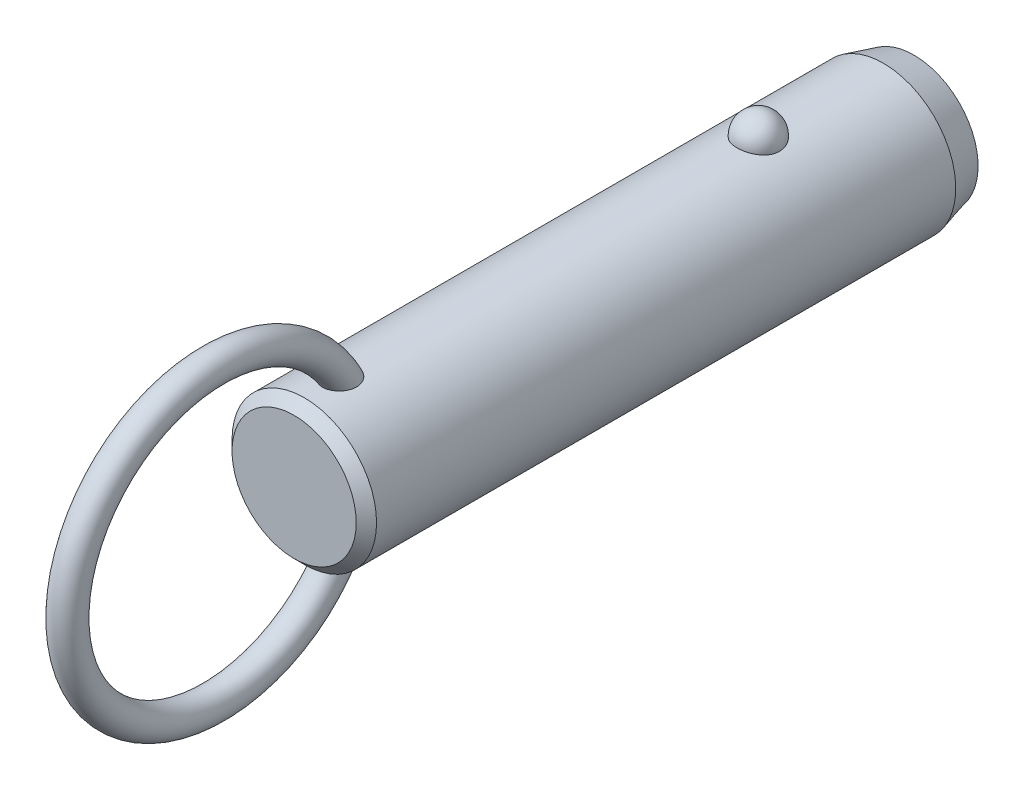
SolidWorks part; units mm, degrees
ref_plane "Front Plane" through (0, 0, 0) normal (0, 0, 1) x (1, 0, 0)
ref_plane "Top Plane" through (0, 0, 0) normal (0, 1, 0) x (1, 0, 0)
ref_plane "Right Plane" through (0, 0, 0) normal (1, 0, 0) x (0, 0, -1)
sketch "Sketch2" plane through (0, 0, 0) normal (0, 0, 1) x (1, 0, 0)
  circle A0 centre (0, 0) radius 7.1
  point P3 (0, 7.1)
  dimension "D1" = 14.2
extrude "Boss-Extrude1" add sketch "Sketch2" along normal blind 35.6
sketch "Sketch3" plane through (0, 0, 0) normal (0, 0, -1) x (-1, 0, 0)
  circle A0 centre (0, 0) radius 7.1
  dimension "D1" = 14.2
extrude "Boss-Extrude2" add sketch "Sketch3" along normal blind 17.4
chamfer "Chamfer1" distance 3 angle 15 1 edges at (-7.1, 0, -17.4)
sketch "Sketch12" plane through (0, 0, 0) normal (1, 0, 0) x (0, 0, -1)
  line L0 (-35.6, 7.1) -> (-35.6, -7.1) construction
  point P0 (-35.6, 0)
sketch "Sketch13" plane through (0, 0, 0) normal (1, 0, 0) x (0, 0, -1)
  circle A0 centre (-51.45, 0) radius 15.85
  point P2 (-35.6, 0)
  dimension "D1" = 31.7
sketch "Sketch14" plane through (0, 0, 0) normal (0, 1, 0) x (1, 0, 0)
  circle A0 centre (0, -37.1) radius 1.5
  point P2 (0, -35.6)
  dimension "D1" = 3
sweep "Sweep1" add profiles "Sketch14" path "Sketch13"
sketch "Sketch15" plane through (0, 0, 35.6) normal (0, 0, 1) x (1, 0, 0)
  circle A0 centre (0, 0) radius 7.1
  dimension "D1" = 14.2
extrude "Boss-Extrude3" add sketch "Sketch15" along normal blind 7.92
chamfer "Chamfer2" distance 1 angle 45 1 edges at (7.1, 0, 43.52)
sketch "Sketch18" plane through (0, 0, 0) normal (1, 0, 0) x (0, 0, -1)
  line L0 (14.4, 7.1) -> (-37.2792, 7.1) construction
  line L1 (2.1, 9.2) -> (2.1, 5)
  line L2 (-37.2792, -7.1) -> (14.4, -7.1) construction
  arc A0 (2.1, 9.2) -> (2.1, 5) centre (2.1, 7.1) ccw
  point P4 (0, 7.1)
  dimension "D1" = 16.3
revolve "Revolve1" add sketch "Sketch18" angle 360 about L1
